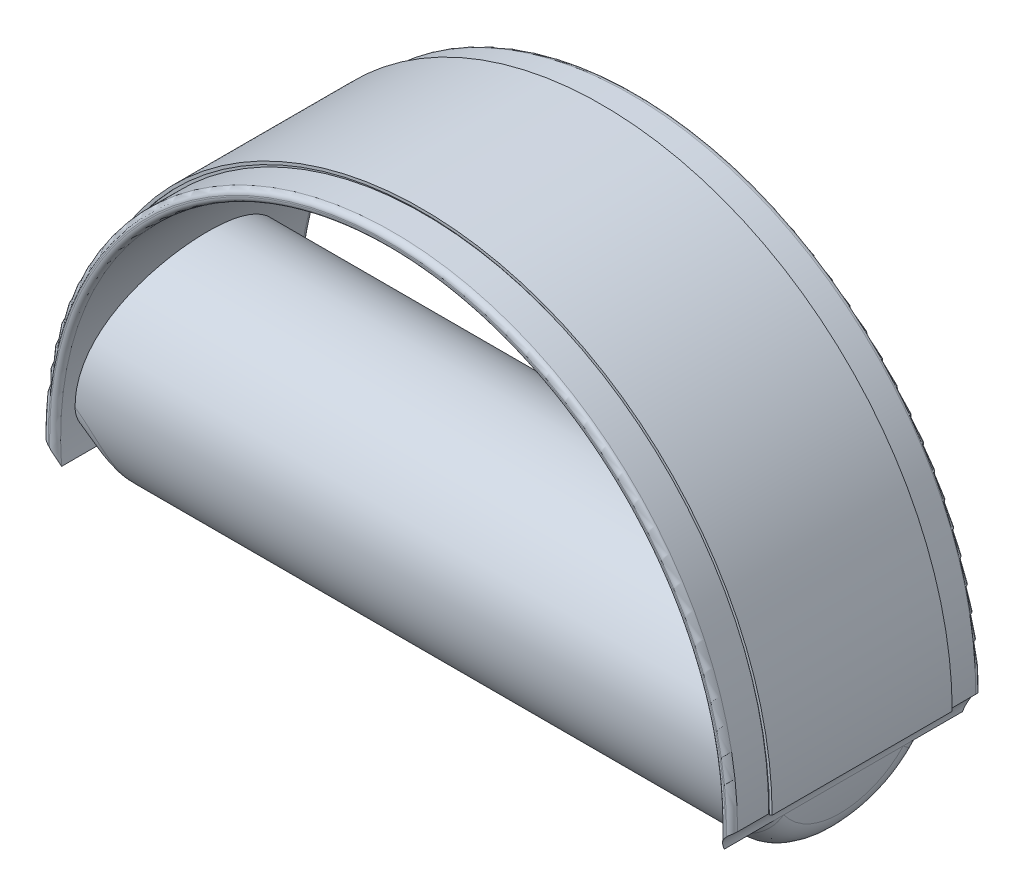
SolidWorks part; units mm, degrees
ref_plane "Front Plane" through (0, 0, 0) normal (0, 0, 1) x (1, 0, 0)
ref_plane "Top Plane" through (0, 0, 0) normal (0, 1, 0) x (1, 0, 0)
ref_plane "Right Plane" through (0, 0, 0) normal (1, 0, 0) x (0, 0, -1)
sketch "Sketch1" plane through (0, 0, 0) normal (0, 0, 1) x (1, 0, 0)
  line L0 (-62.23, 0) -> (62.23, 0) construction
  line L1 (-60, 0) -> (-62.23, 0)
  line L2 (60, 0) -> (62.23, 0)
  arc A0 (-62.23, 0) -> (62.23, 0) centre (0, 0) cw
  arc A1 (-60, 0) -> (60, 0) centre (0, 0) cw
  dimension "D1" = 62.23
  dimension "D2" = 60
extrude "Boss-Extrude1" add sketch "Sketch1" along normal mid plane 45
sketch "Sketch2" plane through (0, 0, 0) normal (0, -1, 0) x (1, 0, 0)
  line L0 (-62.23, 22.5) -> (-62.23, -22.5) construction
  line L1 (-62.23, -15.875) -> (-62.73, -15.875)
  line L2 (-62.23, -15.875) -> (-62.23, 15.875)
  line L3 (-62.23, 15.875) -> (-62.73, 15.875)
  line L5 (-62.23, -15.875) -> (-62.73, 15.875) construction
  line L6 (-62.23, 15.875) -> (-62.73, -15.875) construction
  line L7 (-62.73, 15.875) -> (-62.73, 16.255)
  line L8 (-62.73, -16.255) -> (-63.23, -16.255)
  line L9 (-62.73, -16.255) -> (-62.73, -15.875)
  line L10 (-62.73, 16.255) -> (-63.23, 16.255)
  line L11 (-63.23, -16.255) -> (-63.23, 16.255)
  line L12 (-62.73, -16.255) -> (-63.23, 16.255) construction
  line L13 (-62.73, 16.255) -> (-63.23, -16.255) construction
  point P0 (-62.48, 0)
  point P8 (-62.98, 0)
  dimension "D1" = 31.75
  dimension "D2" = 0.5
  dimension "D3" = 32.51
  dimension "D4" = 0.5
sketch "Sketch3" plane through (0, 0, 0) normal (0, 0, 1) x (1, 0, 0)
  arc A0 (-62.23, 0) -> (62.23, 0) centre (0, 0) cw
  dimension "D1" = 62.23
sweep "Sweep1" add profiles "Sketch2" path "Sketch3"
sketch "Sketch4" plane through (0, 0, 0) normal (1, 0, 0) x (0, 0, -1)
  circle A0 centre (0, 5) radius 19.05
  dimension "D1" = 38.1
  dimension "D2" = 5
extrude "Boss-Extrude2" add sketch "Sketch4" along normal up to surface and the other way up to surface
fillet "Fillet1" radius 5 2 edges at (-60, 0, 0) (60, 0, 0)
fillet "Fillet2" radius 5 2 edges at (58.3475, -13.9847, -1.5765) (-58.3417, -14.0089, 1.2511)
fillet "Fillet3" radius 1 4 edges at (0, 62.23, -22.5) (0, 60, -22.5) (0, 62.23, 22.5) (0, 60, 22.5)
